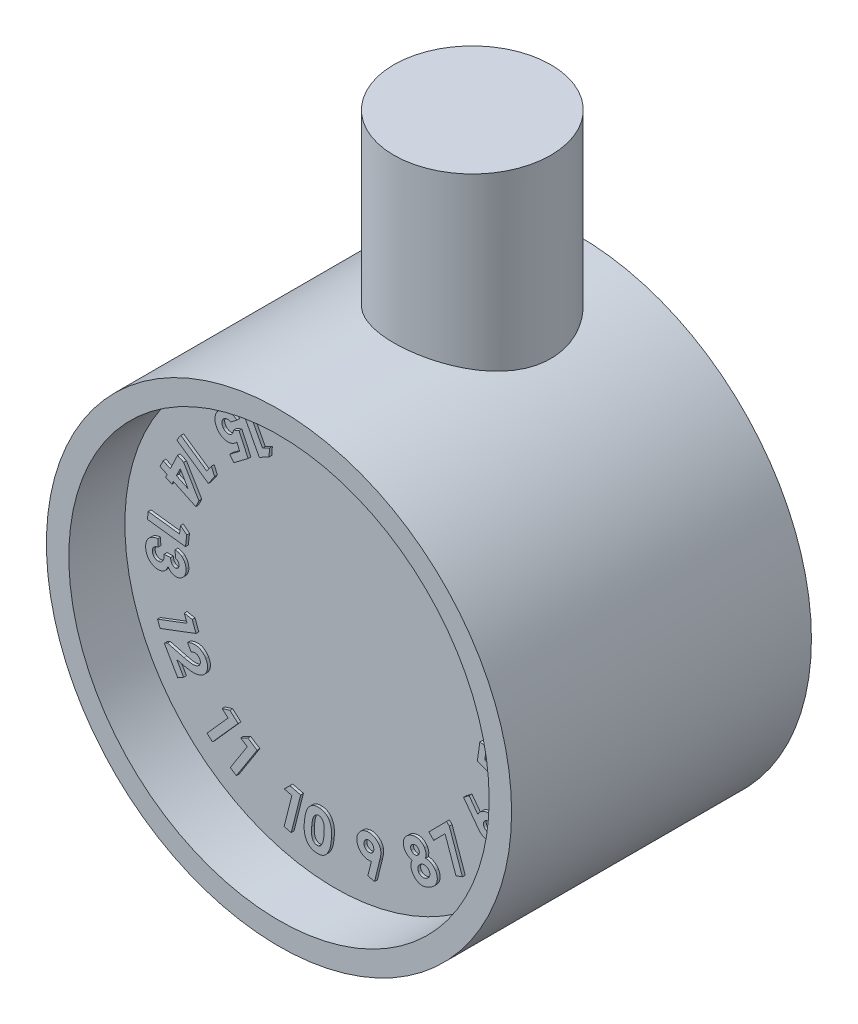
SolidWorks part; units mm, degrees
ref_plane "Front Plane" through (0, 0, 0) normal (0, 0, 1) x (1, 0, 0)
ref_plane "Top Plane" through (0, 0, 0) normal (0, 1, 0) x (1, 0, 0)
ref_plane "Right Plane" through (0, 0, 0) normal (1, 0, 0) x (0, 0, -1)
sketch "Sketch1" plane through (0, 0, 0) normal (0, 0, 1) x (1, 0, 0)
  circle A0 centre (0, 0) radius 21.082
  dimension "D1" = 42.164
extrude "Boss-Extrude1" add sketch "Sketch1" along normal blind 27.178
sketch "Sketch2" plane through (0, 0, 0) normal (0, 1, 0) x (1, 0, 0)
  line L0 (21.082, 0) -> (-21.082, 0) construction
  circle A0 centre (0, -9.652) radius 7.112
  dimension "D1" = 14.224
  dimension "D2" = 9.652
extrude "Boss-Extrude2" add sketch "Sketch2" along normal blind 35.814
sketch "Sketch3" plane through (0, 0, 27.178) normal (0, 0, 1) x (1, 0, 0)
  circle A0 centre (0, 0) radius 19.05
  dimension "D1" = 38.1
extrude "Cut-Extrude1" cut sketch "Sketch3" against normal blind 5.08
sketch "Sketch4" plane through (0, 0, 22.098) normal (0, 0, 1) x (1, 0, 0)
  line L0 (0, 0) -> (5.7762, 15.87) construction
  line L1 (0, 0) -> (0, 38.069) construction
  line L2 (0, 0) -> (-5.7762, 15.87) construction
  arc A0 (5.7762, 15.87) -> (-5.7762, 15.87) centre (0, 0) cw construction
  text T0 "<b>15  14  13  12  11  10  9  8 7  6  5 4 3 2 1 0</b> " font "Century Gothic" height 3.5
  dimension "D1" = 20
  dimension "D2" = 20
extrude "Boss-Extrude3" add sketch "Sketch4" along normal blind 0.254
